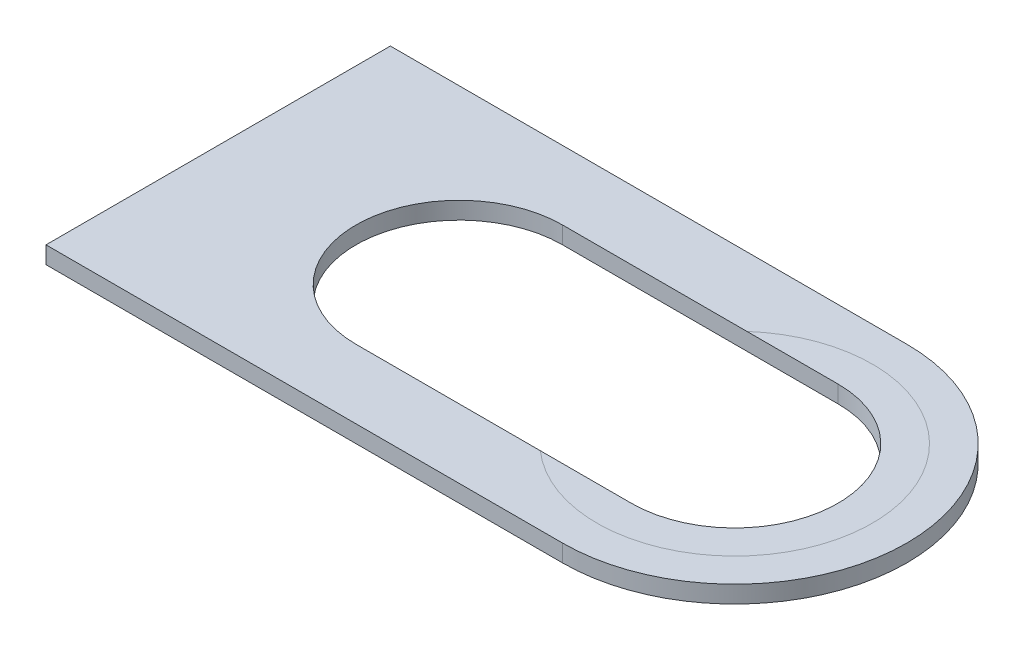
SolidWorks part; units mm, degrees
ref_plane "plane 1" through (0, 0, 0) normal (0, 0, 1) x (1, 0, 0)
ref_plane "plane 2" through (0, 0, 0) normal (0, 1, 0) x (1, 0, 0)
ref_plane "plane 3" through (0, 0, 0) normal (1, 0, 0) x (0, 0, -1)
sketch "Sketch1" plane through (0, 0, 0) normal (0, 0, 1) x (1, 0, 0)
  line L0 (0, 0) -> (-200, 0)
  dimension "D1" = 200
extrude "Base-Extrude-Thin" add sketch "Sketch1" along normal mid plane 100 thin
sketch "Sketch2" plane through (0, 5, 0) normal (0, 1, 0) x (-1, 0, 0)
  line L0 (0, 0) -> (197.8884, 0) construction
  line L5 (0, 50) -> (0, -50) construction
  line L6 (0, -50) -> (200, -50) construction
  line L7 (0, 50) -> (200, 50) construction
  line L8 (0, 50) -> (200, 50) construction
  line L9 (0, -50) -> (200, -50) construction
  arc A0 (50, 50) -> (50, -50) centre (50, 0) ccw
extrude "Cut-Extrude2" cut sketch "Sketch2" against normal through all flip side to cut
sketch "Sketch4" plane through (0, 5, 0) normal (0, 1, 0) x (-1, 0, 0)
  line L0 (0, 0) -> (188.4138, 0) construction
  line L1 (50, 30) -> (130, 30)
  line L2 (50, -30) -> (130, -30)
  arc A0 (50, 30) -> (50, -30) centre (50, 0) ccw
  arc A1 (50, 50) -> (50, -50) centre (50, 0) ccw construction
  arc A2 (130, -30) -> (130, 30) centre (130, 0) ccw
  dimension "D1" = 60
  dimension "D2" = 80
extrude "Cut-Extrude3" cut sketch "Sketch4" against normal through all
sketch "Sketch3" plane through (0, 5, 0) normal (0, 1, 0) x (-1, 0, 0)
  circle A0 centre (50, 0) radius 40
  circle A2 centre (50, 0) radius 30 construction
  dimension "D1" = 80
surface "MidSurface1"
imported_body "Surface-Imported1"
surface "MidSurface3"
imported_body "Surface-Imported3"
